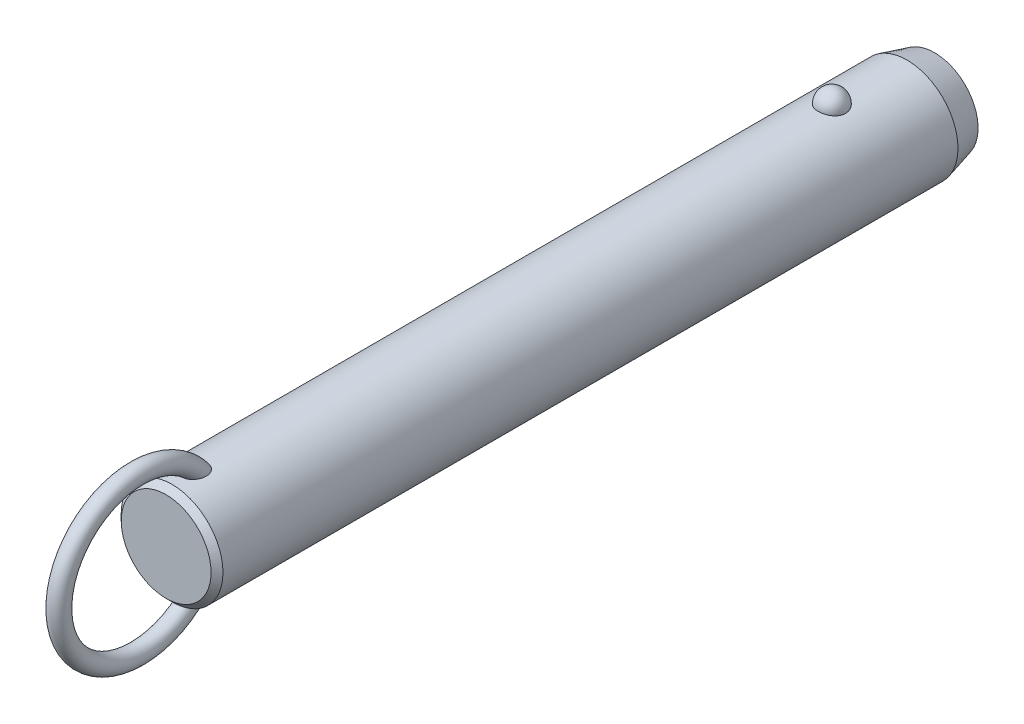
SolidWorks part; units mm, degrees
ref_plane "Front Plane" through (0, 0, 0) normal (0, 0, 1) x (1, 0, 0)
ref_plane "Top Plane" through (0, 0, 0) normal (0, 1, 0) x (1, 0, 0)
ref_plane "Right Plane" through (0, 0, 0) normal (1, 0, 0) x (0, 0, -1)
sketch "Sketch2" plane through (0, 0, 0) normal (0, 0, 1) x (1, 0, 0)
  circle A0 centre (0, 0) radius 11.1
  point P3 (0, 11.1)
  dimension "D1" = 22.2
extrude "Boss-Extrude1" add sketch "Sketch2" along normal blind 129.5
sketch "Sketch3" plane through (0, 0, 0) normal (0, 0, -1) x (-1, 0, 0)
  circle A0 centre (0, 0) radius 11.1
  dimension "D1" = 22.2
extrude "Boss-Extrude2" add sketch "Sketch3" along normal blind 25.4
chamfer "Chamfer1" distance 6 angle 15 1 edges at (-11.1, 0, -25.4)
sketch "Sketch12" plane through (0, 0, 0) normal (1, 0, 0) x (0, 0, -1)
  line L0 (-129.5, 11.1) -> (-129.5, -11.1) construction
  point P0 (-129.5, 0)
sketch "Sketch13" plane through (0, 0, 0) normal (1, 0, 0) x (0, 0, -1)
  circle A0 centre (-148.55, 0) radius 19.05
  point P2 (-129.5, 0)
  dimension "D1" = 38.1
sketch "Sketch14" plane through (0, 0, 0) normal (0, 1, 0) x (1, 0, 0)
  circle A0 centre (0, -131.5) radius 2
  point P2 (0, -129.5)
  dimension "D1" = 4
sweep "Sweep1" add profiles "Sketch14" path "Sketch13"
sketch "Sketch15" plane through (0, 0, 129.5) normal (0, 0, 1) x (1, 0, 0)
  circle A0 centre (0, 0) radius 11.1
  dimension "D1" = 22.2
extrude "Boss-Extrude3" add sketch "Sketch15" along normal blind 12.7
chamfer "Chamfer2" distance 1.3 angle 45 1 edges at (11.1, 0, 142.2)
sketch "Sketch18" plane through (0, 0, 0) normal (1, 0, 0) x (0, 0, -1)
  line L0 (19.4, 11.1) -> (-133.068, 11.1) construction
  line L1 (3, 14.1) -> (3, 8.1)
  line L2 (-133.068, -11.1) -> (19.4, -11.1) construction
  arc A0 (3, 14.1) -> (3, 8.1) centre (3, 11.1) ccw
  point P4 (0, 11.1)
  dimension "D1" = 25.2
revolve "Revolve1" add sketch "Sketch18" angle 360 about L1
